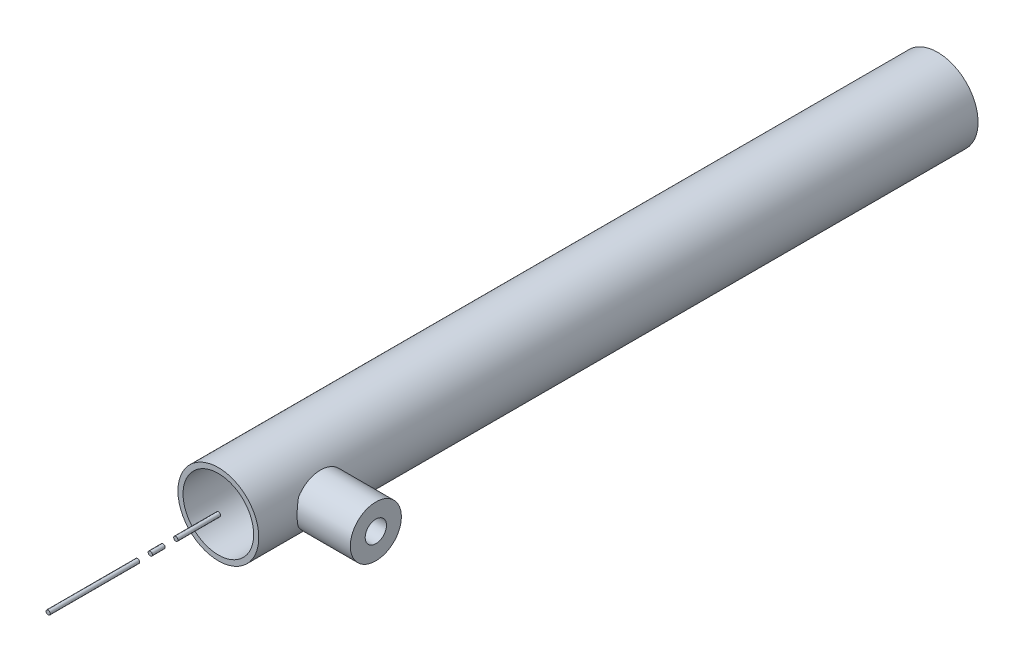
SolidWorks part; units mm, degrees
ref_plane "Plan de face" through (0, 0, 0) normal (0, 0, 1) x (1, 0, 0)
ref_plane "Plan de dessus" through (0, 0, 0) normal (0, 1, 0) x (1, 0, 0)
ref_plane "Plan de droite" through (0, 0, 0) normal (1, 0, 0) x (0, 0, -1)
ref_plane "Plan1" through (0, 0, 0) normal (0, -1, 0) x (1, 0, 0)
sketch "Esquisse1" plane through (0, 0, 0) normal (0, -1, 0) x (1, 0, 0)
  line L0 (9.5, 169) -> (0, 169)
  line L1 (0, 169) -> (0, 0)
  line L2 (0, 0) -> (9.5, 0)
  line L3 (9.5, 0) -> (9.5, 169)
  line L4 (0, 169) -> (0, 0) construction
revolve "Révolution1" add sketch "Esquisse1" angle 360 about L4
ref_plane "Plan2" through (0, -67.2901, 39.5694) normal (0, 0.862, -0.5069) x (-1, 0, 0)
sketch "Esquisse2" plane through (0, -67.2901, 39.5694) normal (0, 0.862, -0.5069) x (-1, 0, 0)
  line L0 (-9, 126.749) -> (-9, 132.749)
  line L1 (-9, 132.749) -> (-22, 132.749)
  line L2 (-22, 132.749) -> (-22, 126.749)
  line L3 (-22, 126.749) -> (-9, 126.749)
  line L4 (-9, 132.749) -> (-22, 132.749) construction
revolve "Révolution2" add sketch "Esquisse2" angle 360 about L4
hole_wizard "Dégagement M141" positions "Esquisse4" profile "Esquisse3" hole size "M14" standard "Ansi Metric"
sketch "Esquisse4" plane through (0, 0, 169) normal (0, 0, 1) x (1, 0, 0)
  point P0 (0, 0)
sketch "Esquisse3" plane through (0, 0, 169) normal (1, 0, 0) x (0, -1, 0)
  line L0 (0, 0) -> (0, 169)
  line L1 (0, 169) -> (8.3, 169)
  line L2 (8.3, 169) -> (8.3, 0)
  line L5 (8.3, 0) -> (0, 0)
  line L11 (0, -6.35) -> (0, 107.95) construction
  dimension "Diamètre du perçage jusqu'au prochain" = 16.6
  dimension "Profondeur du perçage jusqu'au prochain" = 169
hole_wizard "Diamètre du perçage Ø5.0 (5)1" positions "Esquisse6" profile "Esquisse5" hole size "Ø5.0" standard "Ansi Metric"
sketch "Esquisse6" plane through (22, 0, 0) normal (1, 0, 0) x (0, 0, -1)
  point P0 (-154, 0)
sketch "Esquisse5" plane through (22, 0, 154) normal (0, 1, 0) x (0, 0, -1)
  line L0 (0, 0) -> (0, 13)
  line L1 (0, 13) -> (2.5, 13)
  line L2 (2.5, 13) -> (2.5, 0)
  line L5 (2.5, 0) -> (0, 0)
  line L10 (0, 13) -> (-2.5, 13) construction
  line L11 (0, -6.35) -> (0, 107.95) construction
  dimension "Diamètre du perçage" = 5
  dimension "Profondeur du perçage" = 13
  dimension "Angle de pointe" = 180
sketch "Esquisse7" plane through (0, 0, 169) normal (0, 0, 1) x (1, 0, 0)
  circle A1 centre (0, 0) radius 0.5
  dimension "D1" = 1
extrude "Boss.-Extru.1" add sketch "Esquisse7" along normal blind 40 separate body
ref_plane "Plan3" through (0, 0.5, 0) normal (0, 1, 0) x (1, 0, 0)
sketch "Esquisse8" plane through (0, 0.5, 0) normal (0, 1, 0) x (1, 0, 0)
  line L0 (-9.5, -169) -> (9.5, -169) construction
  line L1 (-2.7503, -179) -> (2.6477, -179)
  line L2 (-2.7503, -179) -> (-2.7503, -182)
  line L3 (-2.7503, -182) -> (2.6477, -182)
  line L4 (2.6477, -179) -> (2.6477, -182)
  line L5 (-2.7503, -185) -> (2.6477, -185)
  line L6 (-2.7503, -185) -> (-2.7503, -188)
  line L7 (-2.7503, -188) -> (2.6477, -188)
  line L8 (2.6477, -185) -> (2.6477, -188)
  line L9 (-2.7503, -209) -> (2.6477, -209)
  line L10 (-2.7503, -209) -> (-2.7503, -212)
  line L11 (-2.7503, -212) -> (2.6477, -212)
  line L12 (2.6477, -209) -> (2.6477, -212)
  line L13 (-2.7503, -215) -> (2.6477, -215)
  line L14 (-2.7503, -215) -> (-2.7503, -218)
  line L15 (-2.7503, -218) -> (2.6477, -218)
  line L16 (2.6477, -215) -> (2.6477, -218)
  dimension "D1" = 10
  dimension "D2" = 3
  dimension "D3" = 3
  dimension "D4" = 3
  dimension "D5" = 2
extrude "Enlèv. mat.-Extru.1" cut sketch "Esquisse8" against normal blind 5
